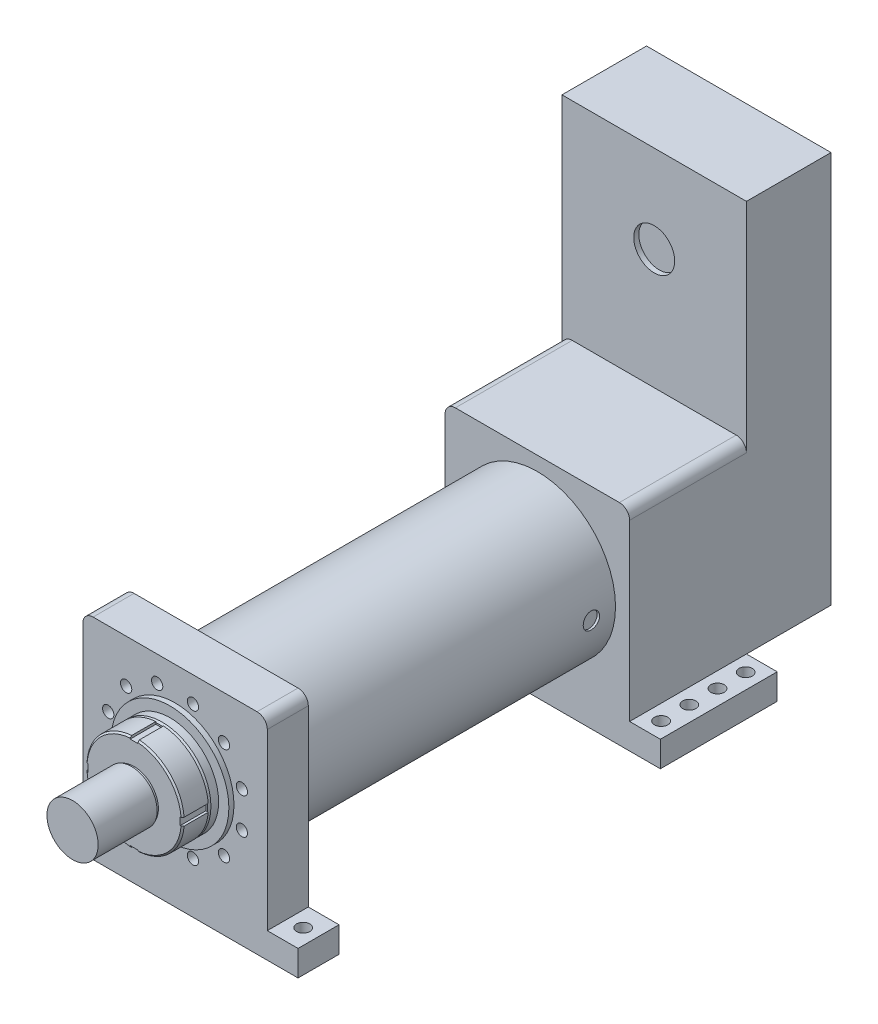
SolidWorks part; units mm, degrees
ref_plane "前视基准面" through (0, 0, 0) normal (0, 0, 1) x (1, 0, 0)
ref_plane "上视基准面" through (0, 0, 0) normal (0, 1, 0) x (1, 0, 0)
ref_plane "右视基准面" through (0, 0, 0) normal (1, 0, 0) x (0, 0, -1)
sketch "草图1" plane through (0, 0, 0) normal (0, 0, 1) x (1, 0, 0)
  circle A0 centre (0, 0) radius 152.5
  dimension "D1" = 305
extrude "凸台-拉伸1" add sketch "草图1" along normal blind 627
sketch "草图2" plane through (0, 0, 627) normal (0, 0, 1) x (1, 0, 0)
  line L0 (0, 0) -> (224.9367, 0) construction
  line L1 (0, 0) -> (223.5406, 59.8975) construction
  line L3 (-180, 180) -> (180, 180)
  line L4 (-180, 180) -> (-180, -180)
  line L5 (-180, -180) -> (180, -180)
  line L6 (180, 180) -> (180, -180)
  line L7 (-180, 180) -> (180, -180) construction
  line L8 (-180, -180) -> (180, 180) construction
  circle A0 centre (0, 0) radius 180 construction
  circle A1 centre (0, 0) radius 135 construction
  circle A2 centre (130.4, 34.9406) radius 11
  circle A3 centre (130.4, -34.9406) radius 11
  circle A4 centre (95.4594, -95.4594) radius 11
  circle A5 centre (34.9406, -130.4) radius 11
  circle A6 centre (-34.9406, -130.4) radius 11
  circle A7 centre (-95.4594, -95.4594) radius 11
  circle A8 centre (-130.4, -34.9406) radius 11
  circle A9 centre (-130.4, 34.9406) radius 11
  circle A10 centre (-95.4594, 95.4594) radius 11
  circle A11 centre (-34.9406, 130.4) radius 11
  circle A12 centre (34.9406, 130.4) radius 11
  circle A13 centre (95.4594, 95.4594) radius 11
  point P32 (0, 0)
  dimension "D1" = 360
  dimension "D2" = 270
  dimension "D3" = 22
  dimension "D4" = 15
  dimension "D6" = 360
  dimension "D7" = 360
  dimension "D5" = 12
extrude "凸台-拉伸2" add sketch "草图2" along normal blind 80
sketch "草图11" plane through (0, 0, 0) normal (0, 0, -1) x (-1, 0, 0)
  line L1 (-180, 180) -> (180, 180)
  line L2 (-180, 180) -> (-180, -180)
  line L3 (-180, -180) -> (180, -180)
  line L4 (180, 180) -> (180, -180)
  line L5 (-180, 180) -> (180, -180) construction
  line L6 (-180, -180) -> (180, 180) construction
  circle A0 centre (0, 0) radius 180 construction
  dimension "D1" = 360
  dimension "D2" = 360
  dimension "D3" = 360
extrude "凸台-拉伸10" add sketch "草图11" along normal blind 50
ref_plane "基准面1" through (152.5, 0, 0) normal (1, 0, 0) x (0, 0, -1)
ref_plane "基准面2" through (-152.5, 0, 0) normal (1, 0, 0) x (0, 0, -1)
sketch "草图14" plane through (152.5, 0, 0) normal (1, 0, 0) x (0, 0, -1)
  circle A0 centre (-47, 0) radius 16
  dimension "D1" = 32
  dimension "D2" = 47
sketch "草图16" plane through (-152.5, 0, 0) normal (1, 0, 0) x (0, 0, -1)
  line L0 (0, 152.5) -> (0, -152.5) construction
  circle A0 centre (-27, 0) radius 16
  circle A1 centre (-551.5, 0) radius 16
  dimension "D1" = 32
  dimension "D2" = 27
  dimension "D3" = 32
sketch "草图21" plane through (0, 0, -50) normal (0, 0, -1) x (-1, 0, 0)
  line L1 (-180, 180) -> (180, 180)
  line L2 (-180, 180) -> (-180, -180)
  line L3 (-180, -180) -> (180, -180)
  line L4 (180, 180) -> (180, -180)
  line L5 (-180, 180) -> (180, -180) construction
  line L6 (-180, -180) -> (180, 180) construction
  circle A0 centre (0, 0) radius 180 construction
  dimension "D1" = 360
  dimension "D2" = 360
  dimension "D3" = 360
extrude "凸台-拉伸14" add sketch "草图21" along normal blind 178 separate body
sketch "草图22" plane through (0, 0, -228) normal (0, 0, -1) x (-1, 0, 0)
  line L0 (-180, -180) -> (180, -180) construction
  line L5 (-180, 585) -> (180, 585)
  line L6 (-180, 585) -> (-180, -180)
  line L7 (-180, -180) -> (180, -180)
  line L8 (180, 585) -> (180, -180)
  line L9 (-180, 585) -> (180, -180) construction
  line L10 (-180, -180) -> (180, 585) construction
  point P0 (0, 202.5)
  point P7 (0, 0)
  dimension "D1" = 360
  dimension "D2" = 765
extrude "凸台-拉伸16" add sketch "草图22" along normal blind 165 separate body contours L6 L7 L8 L5
sketch "草图23" plane through (0, 0, -228) normal (0, 0, 1) x (1, 0, 0)
  line L0 (180, 585) -> (-180, 585) construction
  circle A0 centre (0, 414) radius 40
  dimension "D1" = 80
  dimension "D2" = 171
extrude "切除-拉伸5" cut sketch "草图23" against normal blind 10
extrude "切除-拉伸6" cut sketch "草图16" along normal blind 5
extrude "切除-拉伸7" cut sketch "草图14" against normal blind 5
sketch "草图26" plane through (0, 0, 707) normal (0, 0, 1) x (1, 0, 0)
  circle A0 centre (0, 0) radius 115
  dimension "D1" = 230
extrude "凸台-拉伸21" add sketch "草图26" along normal blind 10
sketch "草图27" plane through (0, 0, 717) normal (0, 0, 1) x (1, 0, 0)
  circle A0 centre (0, 0) radius 95
  dimension "D1" = 190
extrude "凸台-拉伸22" add sketch "草图27" along normal blind 20 separate body
chamfer "倒角1" distance 5 angle 20 1 edges at (95, 0, 737)
sketch "草图28" plane through (0, 0, 737) normal (0, 0, 1) x (1, 0, 0)
  line L0 (0, 95) -> (0, 90) construction
  line L1 (-7.5, 90) -> (7.5, 90)
  line L2 (-7.5, 90) -> (-7.5, 94.7035)
  line L3 (7.5, 90) -> (7.5, 94.7035)
  line L4 (-95, 0) -> (-90, 0) construction
  line L5 (0, -95) -> (0, -90) construction
  line L6 (95, 0) -> (90, 0) construction
  line L7 (-90, 7.5) -> (-90, -7.5)
  line L8 (90, 7.5) -> (90, -7.5)
  line L9 (-7.5, -90) -> (7.5, -90)
  line L10 (90, 7.5) -> (94.7035, 7.5)
  line L11 (90, -7.5) -> (94.7035, -7.5)
  line L12 (-7.5, -90) -> (-7.5, -94.7035)
  line L13 (7.5, -90) -> (7.5, -94.7035)
  line L14 (-90, 7.5) -> (-94.7035, 7.5)
  line L15 (-90, -7.5) -> (-94.7035, -7.5)
  arc A0 (7.5, -94.7035) -> (94.7035, -7.5) centre (0, 0) ccw
  arc A1 (-94.7035, -7.5) -> (-7.5, -94.7035) centre (0, 0) ccw
  arc A2 (94.7035, 7.5) -> (7.5, 94.7035) centre (0, 0) ccw
  arc A3 (-7.5, 94.7035) -> (-94.7035, 7.5) centre (0, 0) ccw
  point P9 (0, 90)
  point P20 (-90, 0)
  point P22 (90, 0)
  point P25 (0, -90)
  dimension "D1" = 190
  dimension "D2" = 5
  dimension "D3" = 15
  dimension "D4" = 5
  dimension "D5" = 5
  dimension "D6" = 5
  dimension "D7" = 15
  dimension "D8" = 15
  dimension "D9" = 15
extrude "凸台-拉伸23" add sketch "草图28" along normal blind 50
sketch "草图29" plane through (0, 0, 787) normal (0, 0, 1) x (1, 0, 0)
  circle A0 centre (0, 0) radius 47.5
  dimension "D1" = 95
extrude "凸台-拉伸24" add sketch "草图29" along normal blind 5
sketch "草图30" plane through (0, 0, 792) normal (0, 0, 1) x (1, 0, 0)
  circle A0 centre (0, 0) radius 50
  dimension "D1" = 100
extrude "凸台-拉伸25" add sketch "草图30" along normal blind 115
chamfer "倒角2" distance 3 angle 45 4 edges at (67.1751, -67.1751, 787) (-67.1751, -67.1751, 787) (67.1751, 67.1751, 787) (-67.1751, 67.1751, 787)
sketch "草图31" plane through (0, -180, 0) normal (0, -1, 0) x (1, 0, 0)
  line L0 (0, 0) -> (0, 91.6586) construction
  line L1 (-240, -228) -> (240, -228)
  line L2 (-240, -228) -> (-240, 0)
  line L3 (-240, 0) -> (240, 0)
  line L4 (240, -228) -> (240, 0)
  line L5 (-240, 627) -> (240, 627)
  line L6 (-240, 627) -> (-240, 707)
  line L7 (-240, 707) -> (240, 707)
  line L8 (240, 627) -> (240, 707)
  line L9 (180, 0) -> (-180, 0) construction
  line L11 (180, -393) -> (180, -228) construction
  circle A0 centre (-210, -196.5) radius 13
  circle A1 centre (-210, -141.5) radius 13
  circle A2 centre (-210, -86.5) radius 13
  circle A3 centre (-210, -31.5) radius 13
  circle A4 centre (-210, 667) radius 13
  circle A5 centre (210, 667) radius 13
  circle A6 centre (210, -31.5) radius 13
  circle A7 centre (210, -86.5) radius 13
  circle A8 centre (210, -141.5) radius 13
  circle A9 centre (210, -196.5) radius 13
  dimension "D5" = 26
  dimension "D6" = 26
  dimension "D7" = 26
  dimension "D8" = 26
  dimension "D14" = 26
  dimension "D1" = 480
  dimension "D2" = 480
  dimension "D3" = 60
  dimension "D4" = 60
  dimension "D9" = 55
  dimension "D10" = 55
  dimension "D11" = 55
  dimension "D12" = 210
  dimension "D13" = 40
  dimension "D15" = 210
  dimension "D16" = 31.5
  dimension "D17" = 228
extrude "凸台-拉伸28" add sketch "草图31" along normal blind 50
fillet "圆角4" radius 20 4 edges at (180, 180, 667) (-180, 180, 667) (180, 180, -114) (-180, 180, -114)
